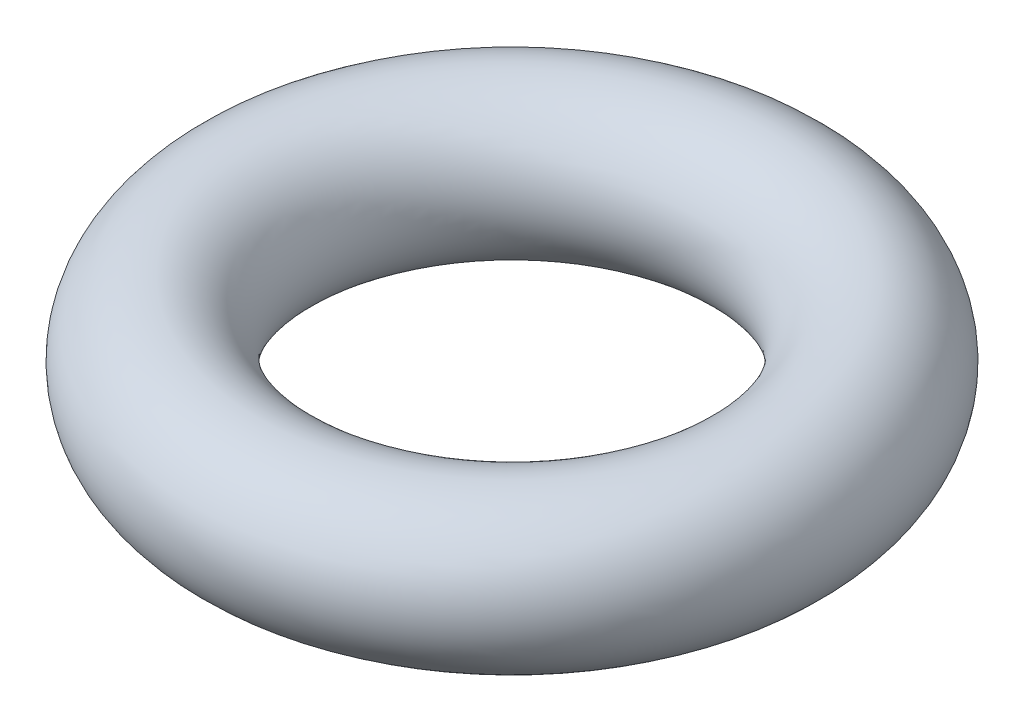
SolidWorks part; units mm, degrees
ref_plane "Plan de face" through (0, 0, 0) normal (0, 0, 1) x (1, 0, 0)
ref_plane "Plan de dessus" through (0, 0, 0) normal (0, 1, 0) x (1, 0, 0)
ref_plane "Plan de droite" through (0, 0, 0) normal (1, 0, 0) x (0, 0, -1)
sketch "Esquisse1" plane through (0, 0, 0) normal (0, 0, 1) x (1, 0, 0)
  line L0 (0, 0) -> (0, 8.0221) construction
  line L1 (0, 0) -> (2.7, 0) construction
  circle A0 centre (2.7, 0) radius 0.8
  point P5 (3.5, 0)
  dimension "D2" = 1.6
  dimension "D1" = 7
revolve "Révolution1" add sketch "Esquisse1" angle 360 about L0
